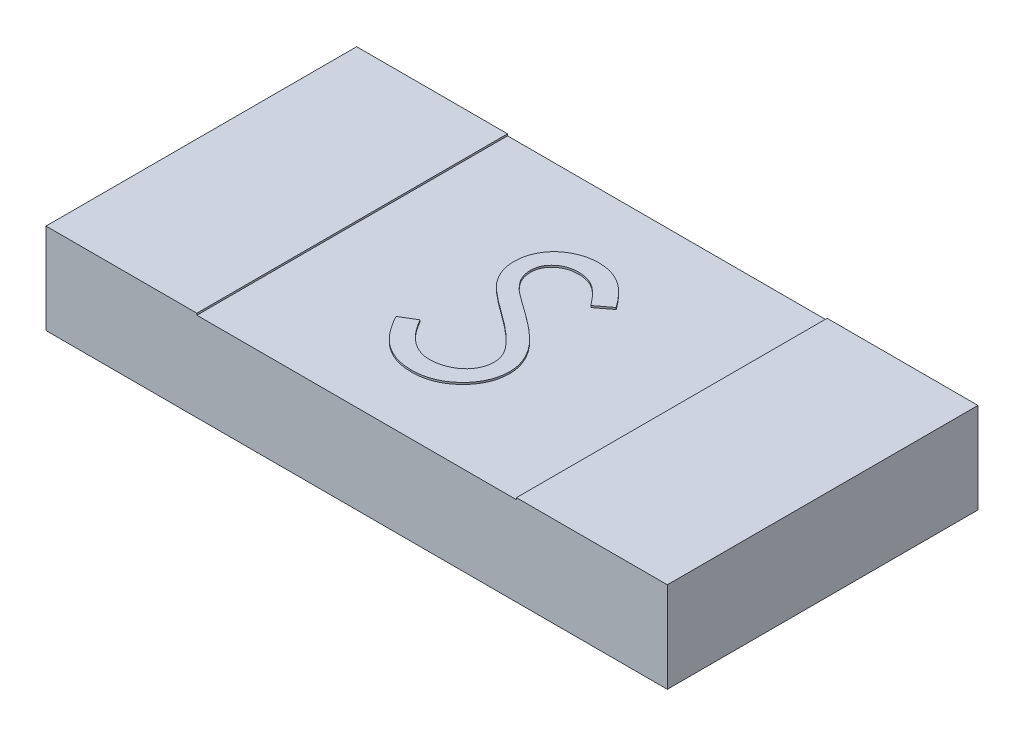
SolidWorks part; units mm, degrees
ref_plane "Plan de face" through (0, 0, 0) normal (0, 0, 1) x (1, 0, 0)
ref_plane "Plan de dessus" through (0, 0, 0) normal (0, 1, 0) x (1, 0, 0)
ref_plane "Plan de droite" through (0, 0, 0) normal (1, 0, 0) x (0, 0, -1)
sketch "Esquisse1" plane through (0, 0, 0) normal (0, 1, 0) x (1, 0, 0)
  line L1 (1.75, -0.875) -> (-1.75, -0.875)
  line L2 (1.75, -0.875) -> (1.75, 0.875)
  line L3 (1.75, 0.875) -> (-1.75, 0.875)
  line L4 (-1.75, -0.875) -> (-1.75, 0.875)
  line L5 (1.75, -0.875) -> (-1.75, 0.875) construction
  line L6 (1.75, 0.875) -> (-1.75, -0.875) construction
  point P0 (0, 0)
  point P6 (1.75, 0)
  dimension "D1" = 3.5
  dimension "D2" = 1.75
extrude "Boss.-Extru.1" add sketch "Esquisse1" along normal blind 0.5
sketch "Esquisse2" plane through (0, 0.5, 0) normal (0, 1, 0) x (1, 0, 0)
  line L0 (-1.75, -0.875) -> (1.75, -0.875) construction
  line L1 (-1.75, 0.875) -> (-0.9, 0.875)
  line L2 (-1.75, 0.875) -> (-1.75, -0.875)
  line L3 (-1.75, -0.875) -> (-0.9, -0.875)
  line L4 (-0.9, 0.875) -> (-0.9, -0.875)
  line L5 (0, 0.9833) -> (0, -1.0587) construction
  line L6 (0.9, 0.875) -> (0.9, -0.875)
  line L7 (1.75, -0.875) -> (0.9, -0.875)
  line L8 (1.75, 0.875) -> (0.9, 0.875)
  line L9 (1.75, 0.875) -> (1.75, -0.875)
  dimension "D1" = 0.85
extrude "Boss.-Extru.2" add sketch "Esquisse2" along normal blind 0.01
sketch "Esquisse3" plane through (0, 0.5, 0) normal (0, 1, 0) x (1, 0, 0)
  line L0 (-0.3491, -0.5228) -> (0.402, -0.5228) construction
  text T0 "S" font "Century Gothic" height 1
extrude "Boss.-Extru.3" add sketch "Esquisse3" along normal blind 0.01
